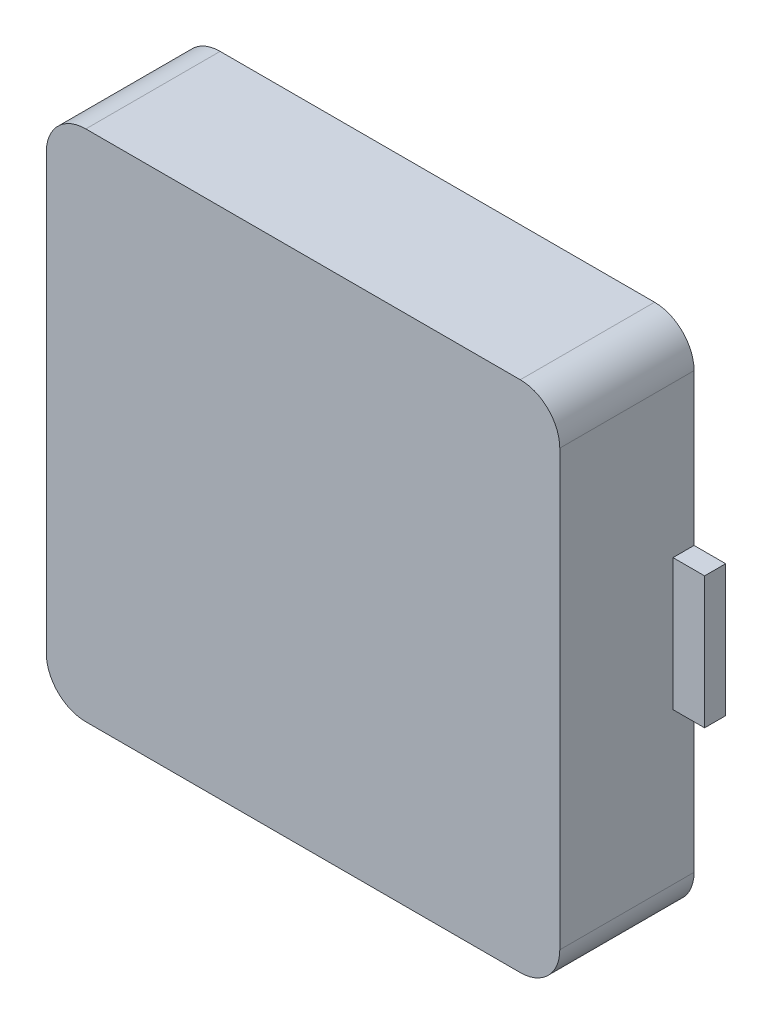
SolidWorks part; units mm, degrees
ref_plane "Спереди" through (0, 0, 0) normal (0, 0, 1) x (1, 0, 0)
ref_plane "Сверху" through (0, 0, 0) normal (0, 1, 0) x (1, 0, 0)
ref_plane "Справа" through (0, 0, 0) normal (1, 0, 0) x (0, 0, -1)
sketch "Эскиз1" plane through (0, 0, 0) normal (0, 0, 1) x (1, 0, 0)
  line L1 (-9.75, -9.75) -> (9.75, -9.75)
  line L2 (-9.75, -9.75) -> (-9.75, 9.75)
  line L3 (-9.75, 9.75) -> (9.75, 9.75)
  line L4 (9.75, -9.75) -> (9.75, 9.75)
  line L5 (-9.75, -9.75) -> (9.75, 9.75) construction
  line L6 (-9.75, 9.75) -> (9.75, -9.75) construction
  point P0 (0, 0)
  dimension "D1" = 19.5
  dimension "D2" = 19.5
extrude "Бобышка-Вытянуть1" add sketch "Эскиз1" along normal blind 0.6
ref_plane "Плоскость2" through (0, 0, 0) normal (1, 0, 0) x (0, 0, -1)
sketch "Эскиз3" plane through (0, 0, 0) normal (1, 0, 0) x (0, 0, -1)
  line L0 (0, 0) -> (12.6791, 0) construction
  line L1 (0, 3.15) -> (4.5, 3.25)
  line L2 (0, 9.75) -> (0, -9.75) construction
  line L3 (4.5, 3.25) -> (4.5, 5.6506)
  line L4 (4.5, 5.6506) -> (0, 5.5506)
  line L5 (0, 5.5506) -> (0, 3.15)
revolve "Повернуть1" add sketch "Эскиз3" angle 360 about L0
ref_plane "Плоскость3" through (0, 0, 0.6) normal (0, 0, 1) x (1, 0, 0)
ref_plane "Плоскость4" through (0, 0, 0) normal (0, 0, -1) x (-1, 0, 0)
sketch "Эскиз5" plane through (0, 0, 0) normal (0, 0, -1) x (-1, 0, 0)
  line L14 (-9.75, -9.75) -> (9.75, -9.75)
  line L15 (9.75, -9.75) -> (9.75, 9.75)
  line L16 (9.75, 9.75) -> (-9.75, 9.75)
  line L17 (-9.75, 9.75) -> (-9.75, -9.75)
  line L18 (-9.75, -9.75) -> (9.75, -9.75)
  line L19 (9.75, -9.75) -> (9.75, 9.75)
  line L20 (9.75, 9.75) -> (-9.75, 9.75)
  line L21 (-9.75, 9.75) -> (-9.75, -9.75)
  circle A0 centre (0, 0) radius 5.5506
  circle A1 centre (0, 0) radius 5.5506 construction
  dimension "D1" = 0
extrude "Бобышка-Вытянуть2" add sketch "Эскиз5" along normal blind 4.5
fillet "Скругление1" radius 1.5 4 edges at (9.75, -9.75, -1.95) (-9.75, -9.75, -1.95) (-9.75, 9.75, -1.95) (9.75, 9.75, -1.95)
sketch "Эскиз4" plane through (0, 0, 0.6) normal (0, 0, 1) x (1, 0, 0)
  line L0 (0, 0) -> (0, 9.75) construction
  line L1 (8.25, 9.75) -> (-8.25, 9.75) construction
  line L2 (-9.75, 4) -> (9.75, 4) construction
  line L4 (-9.75, 8.25) -> (-9.75, -8.25) construction
  line L5 (9.75, -8.25) -> (9.75, 8.25) construction
  circle A2 centre (-4.75, 4) radius 2.25
  circle A3 centre (4.75, 4) radius 2.25
  dimension "D1" = 4.5
  dimension "D3" = 4.5
  dimension "D2" = 4
  dimension "D4" = 5
  dimension "D5" = 5
extrude "Вырез-Вытянуть1" [suppressed] cut sketch "Эскиз4" against normal blind 1.2
ref_plane "Плоскость5" through (0, 0, 0.6) normal (0, 0, 1) x (1, 0, 0)
sketch "Эскиз6" plane through (0, 0, 0.6) normal (0, 0, 1) x (1, 0, 0)
  line L0 (0, 9.75) -> (0, -9.75) construction
  line L1 (8.25, 9.75) -> (-8.25, 9.75) construction
  line L2 (-8.25, -9.75) -> (8.25, -9.75) construction
  line L4 (-3.5, 9.75) -> (3.5, 9.75)
  line L5 (-3.5, 9.75) -> (-3.5, 7.25)
  line L6 (-3.5, 7.25) -> (3.5, 7.25)
  line L7 (3.5, 9.75) -> (3.5, 7.25)
  line L8 (-3.5, -9.75) -> (3.5, -9.75)
  line L9 (-3.5, -9.75) -> (-3.5, -7.25)
  line L10 (-3.5, -7.25) -> (3.5, -7.25)
  line L11 (3.5, -9.75) -> (3.5, -7.25)
extrude "Вырез-Вытянуть2" [suppressed] cut sketch "Эскиз6" against normal blind 2
ref_plane "Плоскость6" through (0, 0, -4.5) normal (0, 0, -1) x (-1, 0, 0)
sketch "Эскиз7" plane through (0, 0, -4.5) normal (0, 0, -1) x (-1, 0, 0)
  line L0 (-9.75, 0) -> (9.75, 0) construction
  line L1 (-9.75, 8.25) -> (-9.75, -8.25) construction
  line L2 (9.75, -8.25) -> (9.75, 8.25) construction
  line L4 (-9.75, 2.5) -> (-10.95, 2.5)
  line L5 (-9.75, 2.5) -> (-9.75, -2.5)
  line L6 (-9.75, -2.5) -> (-10.95, -2.5)
  line L7 (-10.95, 2.5) -> (-10.95, -2.5)
  line L12 (9.75, 7.5) -> (10.95, 7.5)
  line L13 (9.75, 7.5) -> (9.75, 3.5)
  line L14 (9.75, 3.5) -> (10.95, 3.5)
  line L15 (10.95, 7.5) -> (10.95, 3.5)
  line L16 (9.75, -3.5) -> (10.95, -3.5)
  line L17 (9.75, -3.5) -> (9.75, -7.5)
  line L18 (9.75, -7.5) -> (10.95, -7.5)
  line L19 (10.95, -3.5) -> (10.95, -7.5)
  dimension "D1" = 5
  dimension "D2" = 4
  dimension "D3" = 2.5
  dimension "D4" = 4
  dimension "D5" = 1.2
  dimension "D6" = 1.2
  dimension "D7" = 3.5
  dimension "D8" = 3.5
extrude "Бобышка-Вытянуть3" add sketch "Эскиз7" against normal blind 0.8
equation "\"D4@Эскиз3\" = \"D2@Эскиз3\" + 0.1"
equation "\"D2@Эскиз6\"= \"D1@Эскиз6\" / 2"
equation "\"D4@Эскиз6\"= \"D3@Эскиз6\""
